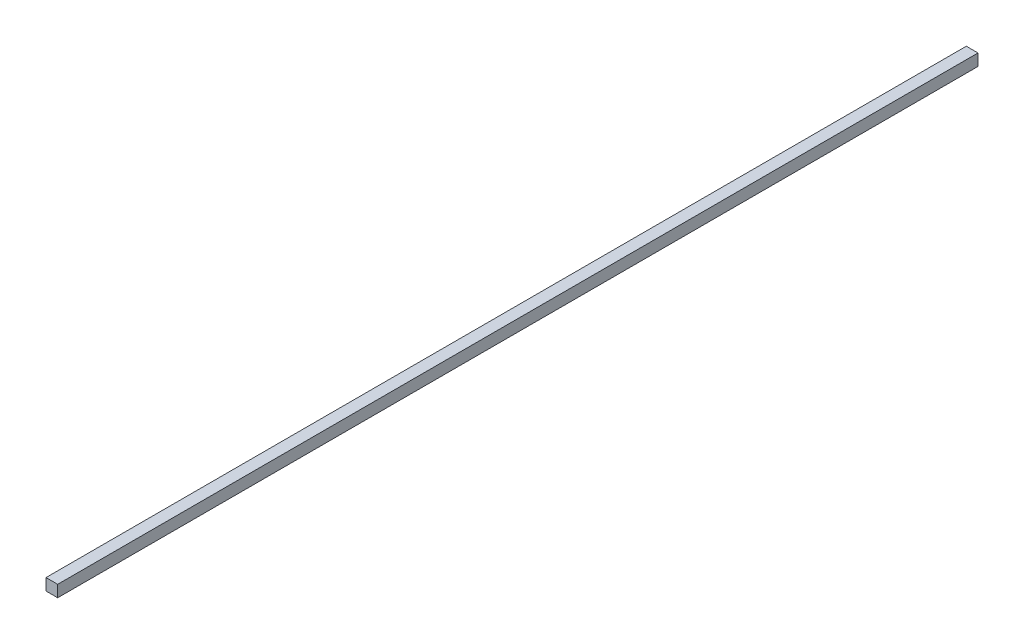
SolidWorks part; units mm, degrees
ref_plane "Front" through (0, 0, 0) normal (0, 0, 1) x (1, 0, 0)
ref_plane "Top" through (0, 0, 0) normal (0, 1, 0) x (1, 0, 0)
ref_plane "Right" through (0, 0, 0) normal (1, 0, 0) x (0, 0, -1)
sketch "Sketch1" plane through (0, 0, 0) normal (0, 0, 1) x (1, 0, 0)
  line L1 (0, 0) -> (12.7, 0)
  line L2 (0, 0) -> (0, 12.7)
  line L3 (0, 12.7) -> (12.7, 12.7)
  line L4 (12.7, 0) -> (12.7, 12.7)
  dimension "D1" = 12.7
  dimension "D2" = 12.7
extrude "Extrude1" add sketch "Sketch1" along normal blind 999.998
